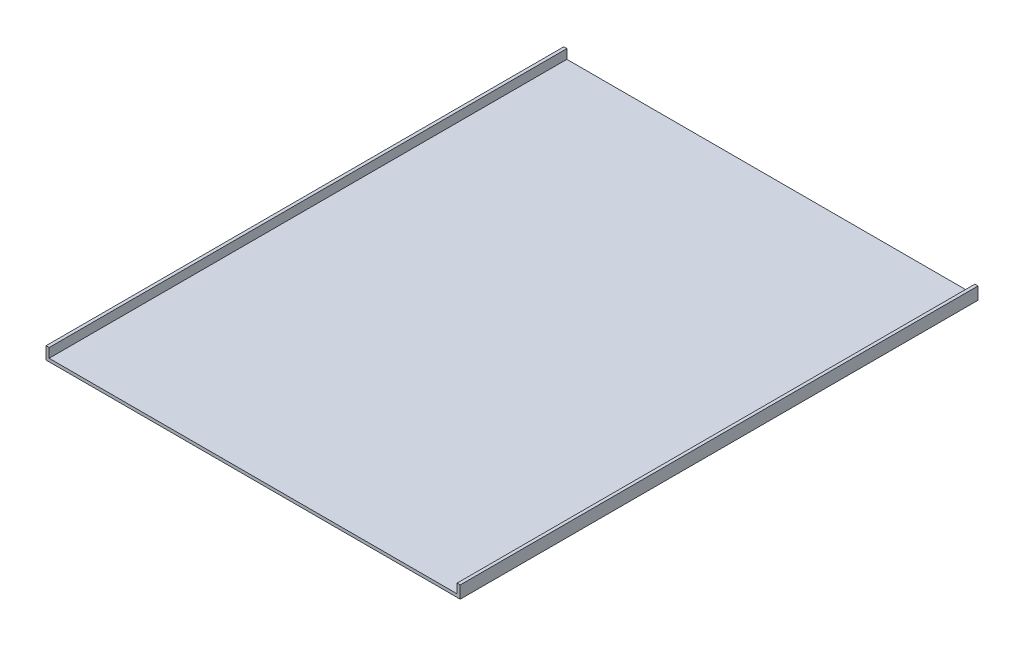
SolidWorks part; units mm, degrees
ref_plane "Ebene vorne" through (0, 0, 0) normal (0, 0, 1) x (1, 0, 0)
ref_plane "Ebene oben" through (0, 0, 0) normal (0, 1, 0) x (1, 0, 0)
ref_plane "Ebene rechts" through (0, 0, 0) normal (1, 0, 0) x (0, 0, -1)
sketch "Skizze1" plane through (0, 0, 0) normal (0, 0, 1) x (1, 0, 0)
  line L0 (0, 12) -> (0, 0)
  line L1 (0, 0) -> (400, 0)
  line L2 (400, 0) -> (400, 12)
  dimension "D1" = 400
  dimension "D2" = 12
  dimension "D3" = 12
extrude "Linear-Austragen-Dünn1" add sketch "Skizze1" along normal blind 500 thin
